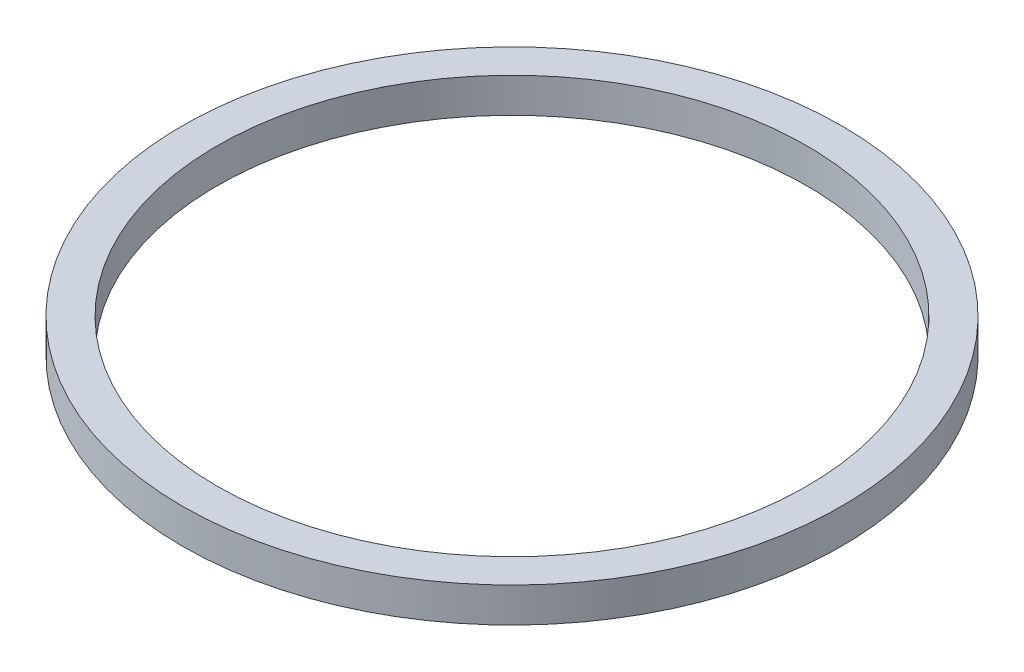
SolidWorks part; units mm, degrees
ref_plane "Front Plane" through (0, 0, 0) normal (0, 0, 1) x (1, 0, 0)
ref_plane "Top Plane" through (0, 0, 0) normal (0, 1, 0) x (1, 0, 0)
ref_plane "Right Plane" through (0, 0, 0) normal (1, 0, 0) x (0, 0, -1)
sketch "Sketch1" plane through (0, 0, 0) normal (0, 1, 0) x (1, 0, 0)
  circle A0 centre (0, 0) radius 60.325
  circle A1 centre (0, 0) radius 53.975
  dimension "D1" = 120.65
  dimension "D2" = 107.95
extrude "Extrude1" add sketch "Sketch1" along normal blind 6.35
